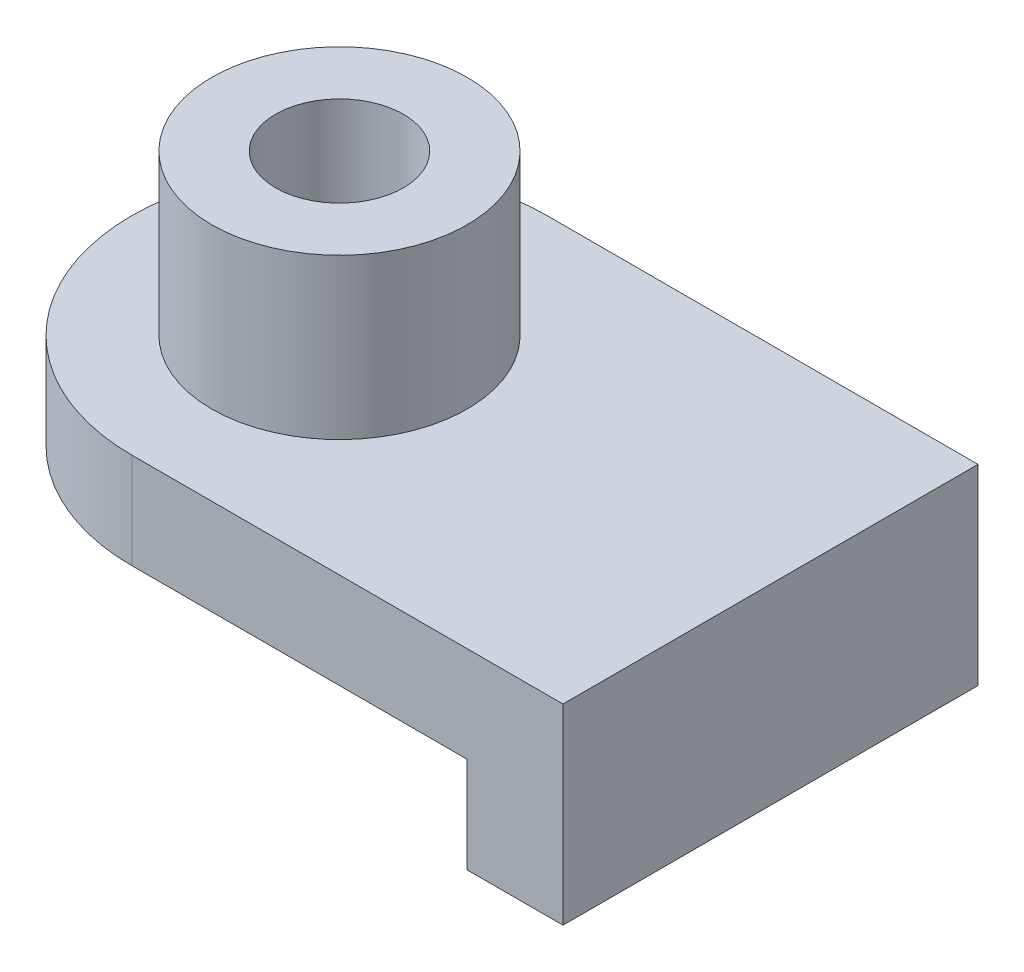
SolidWorks part; units mm, degrees
ref_plane "Alzado" through (0, 0, 0) normal (0, 0, 1) x (1, 0, 0)
ref_plane "Planta" through (0, 0, 0) normal (0, 1, 0) x (1, 0, 0)
ref_plane "Vista lateral" through (0, 0, 0) normal (1, 0, 0) x (0, 0, -1)
sketch "Sketch1" plane through (0, 0, 0) normal (0, 1, 0) x (1, 0, 0)
  line L0 (0, 0) -> (0, 65)
  line L1 (0, 65) -> (-67.5, 65)
  line L2 (-67.5, 0) -> (0, 0)
  arc A0 (-67.5, 65) -> (-67.5, 0) centre (-67.5, 32.5) ccw
  point P6 (0, 32.5)
  dimension "D1" = 67.5
  dimension "D2" = 65
extrude "Boss-Extrude1" add sketch "Sketch1" along normal blind 15
sketch "Sketch2" plane through (0, 0, 0) normal (0, 0, 1) x (1, 0, 0)
  line L0 (0, 0) -> (0, -15)
  line L1 (0, -15) -> (-15, -15)
  line L2 (-15, -15) -> (-15, 0)
  line L3 (-67.5, 0) -> (0, 0) construction
  line L4 (-15, 0) -> (0, 0)
  dimension "D1" = 15
  dimension "D2" = 15
extrude "Boss-Extrude2" add sketch "Sketch2" against normal blind 65
sketch "Sketch4" plane through (0, 15, 0) normal (0, 1, 0) x (1, 0, 0)
  circle A0 centre (-67.5, 32.5) radius 20
  arc A1 (-67.5, 65) -> (-67.5, 0) centre (-67.5, 32.5) ccw construction
  dimension "D1" = 40
extrude "Boss-Extrude3" add sketch "Sketch4" along normal blind 25 contours A0
sketch "Sketch5" plane through (0, 40, 0) normal (0, 1, 0) x (1, 0, 0)
  circle A0 centre (-67.5, 32.5) radius 10
  circle A1 centre (-67.5, 32.5) radius 20 construction
  dimension "D1" = 20
extrude "Cut-Extrude1" cut sketch "Sketch5" against normal through all contours A0
